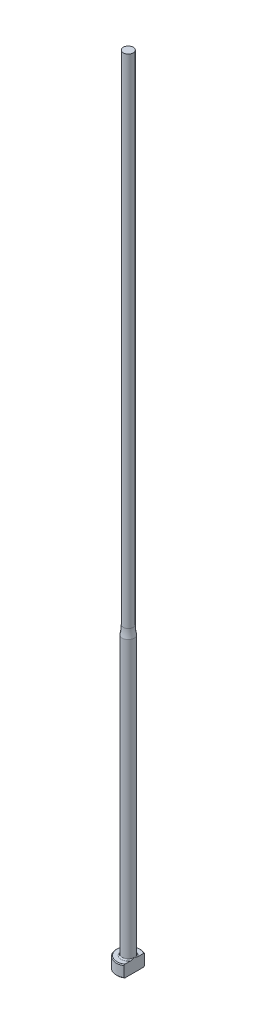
SolidWorks part; units mm, degrees
ref_plane "Front Plane" through (0, 0, 0) normal (0, 0, 1) x (1, 0, 0)
ref_plane "Top Plane" through (0, 0, 0) normal (0, 1, 0) x (1, 0, 0)
ref_plane "Right Plane" through (0, 0, 0) normal (1, 0, 0) x (0, 0, -1)
sketch "Sketch1" plane through (0, 0, 0) normal (0, 0, 1) x (1, 0, 0)
  line L0 (0, 259.9588) -> (0, -15.1925) construction
  line L1 (0, 0) -> (-3, 0)
  line L2 (-3, 0) -> (-3, 3)
  line L3 (-3, 3) -> (-1.5, 3)
  line L4 (-1.25, 75) -> (-1.25, 200)
  line L5 (-1.25, 200) -> (0, 200)
  line L6 (0, 200) -> (0, 0)
  line L7 (-1.5, 3) -> (-1.5, 72.778)
  arc A0 (-1.5, 72.778) -> (-1.25, 75) centre (-11.25, 75) ccw
  point P13 (-1.5, 0)
  dimension "D1" = 10
  dimension "L" = 200
  dimension "H" = 6
  dimension "T" = 3
  dimension "D" = 2.5
  dimension "B" = 3
  dimension "S" = 75
revolve "Revolve1" add sketch "Sketch1" angle 360 about L0
chamfer "Chamfer1" distance 0.2 angle 45 2 edges at (0, 3, 3) (0, 0, 3)
fillet "Fillet1" radius 0.3 1 edges at (0, 3, 1.5)
sketch "Sketch2" plane through (0, 0, 0) normal (0, 1, 0) x (1, 0, 0)
  line L0 (1.5, 2.5981) -> (1.5, -2.5981)
  circle A0 centre (0, 0) radius 3 construction
  arc A1 (1.5, -2.5981) -> (1.5, 2.5981) centre (0, 0) ccw
  circle A2 centre (0, 0) radius 1.5 construction
extrude "KEY" cut sketch "Sketch2" along normal through all
